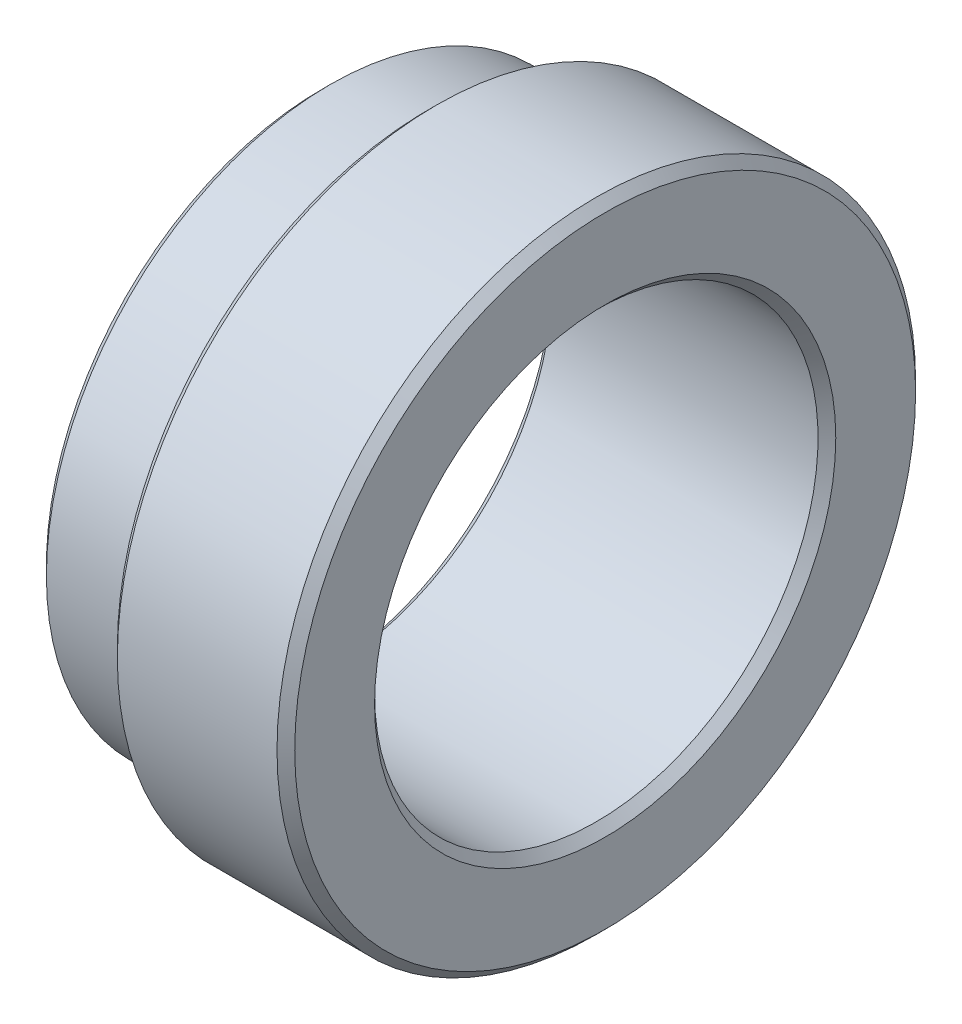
SolidWorks part; units mm, degrees
ref_plane "Front" through (0, 0, 0) normal (0, 0, 1) x (1, 0, 0)
ref_plane "Top" through (0, 0, 0) normal (0, 1, 0) x (1, 0, 0)
ref_plane "Right" through (0, 0, 0) normal (1, 0, 0) x (0, 0, -1)
sketch "Esquisse1" plane through (0, 0, 0) normal (0, 1, 0) x (1, 0, 0)
  line L0 (0, 6.25) -> (8, 6.25)
  line L1 (8, 6.25) -> (8, 9)
  line L2 (8, 9) -> (3, 9)
  line L3 (3, 9) -> (3, 8)
  line L4 (3, 8) -> (0, 8)
  line L5 (0, 8) -> (0, 6.25)
  line L6 (0, 0) -> (55.0569, 0) construction
  dimension "D1" = 9
  dimension "D2" = 8
  dimension "D3" = 3
  dimension "D4" = 8
  dimension "D5" = 6.25
revolve "Révolution1" add sketch "Esquisse1" angle 360 about L6
chamfer "Chanfrein1" distance 0.25 angle 45 5 edges at (0, 0, 6.25) (0, 0, 8) (3, 0, 9) (8, 0, 6.25) (8, 0, 9)
